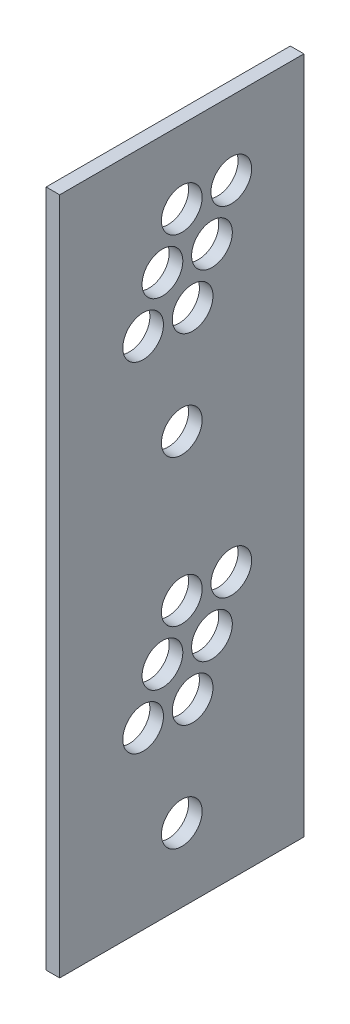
SolidWorks part; units mm, degrees
ref_plane "Alzado" through (0, 0, 0) normal (0, 0, 1) x (1, 0, 0)
ref_plane "Planta" through (0, 0, 0) normal (0, 1, 0) x (1, 0, 0)
ref_plane "Vista lateral" through (0, 0, 0) normal (1, 0, 0) x (0, 0, -1)
sketch "Croquis3" plane through (-182.6952, 0, 0) normal (-1, 0, 0) x (0, 0, 1)
  line L0 (0, 500) -> (0, 0)
  line L1 (0, 500) -> (-180, 500)
  line L2 (0, 0) -> (-180, 0)
  line L3 (-180, 500) -> (-180, 0)
  point P0 (-176.2619, 0)
  dimension "D1" = 180
extrude "Saliente-Extruir1" add sketch "Croquis3" along normal blind 10
sketch "Croquis5" plane through (-192.6952, 0, 0) normal (-1, 0, 0) x (0, 0, 1)
  line L0 (-180, 250) -> (0, 250) construction
  line L1 (-180, 500) -> (-180, 0) construction
  line L2 (0, 0) -> (0, 500) construction
  line L3 (-90, 54) -> (-90, 0) construction
  line L4 (-180, 0) -> (0, 0) construction
  line L5 (-90, 196) -> (-90, 250) construction
  line L6 (0, 54) -> (-180, 54) construction
  circle A0 centre (-90, 54) radius 15
  circle A1 centre (-98, 129) radius 15
  circle A2 centre (-112.25, 162.5) radius 15
  circle A3 centre (-126.5, 196) radius 15
  circle A4 centre (-75.75, 162.5) radius 15
  circle A5 centre (-90, 196) radius 15
  circle A8 centre (-61.5, 129) radius 15
  point P12 (-90, 54)
  point P13 (-126.5, 196)
  dimension "D1" = 30
  dimension "D2" = 75
  dimension "D3" = 8
  dimension "D4" = 33.5
  dimension "D5" = 14.25
  dimension "D6" = 14.25
  dimension "D7" = 33.5
  dimension "D8" = 36.5
  dimension "D10" = 14.25
  dimension "D11" = 36.5
extrude "Cortar-Extruir2" cut sketch "Croquis5" against normal through all both and the other way through all
pattern_linear "MatrizL1" count 2 spacing 250 along (0, 1, 0) of "Cortar-Extruir2"
